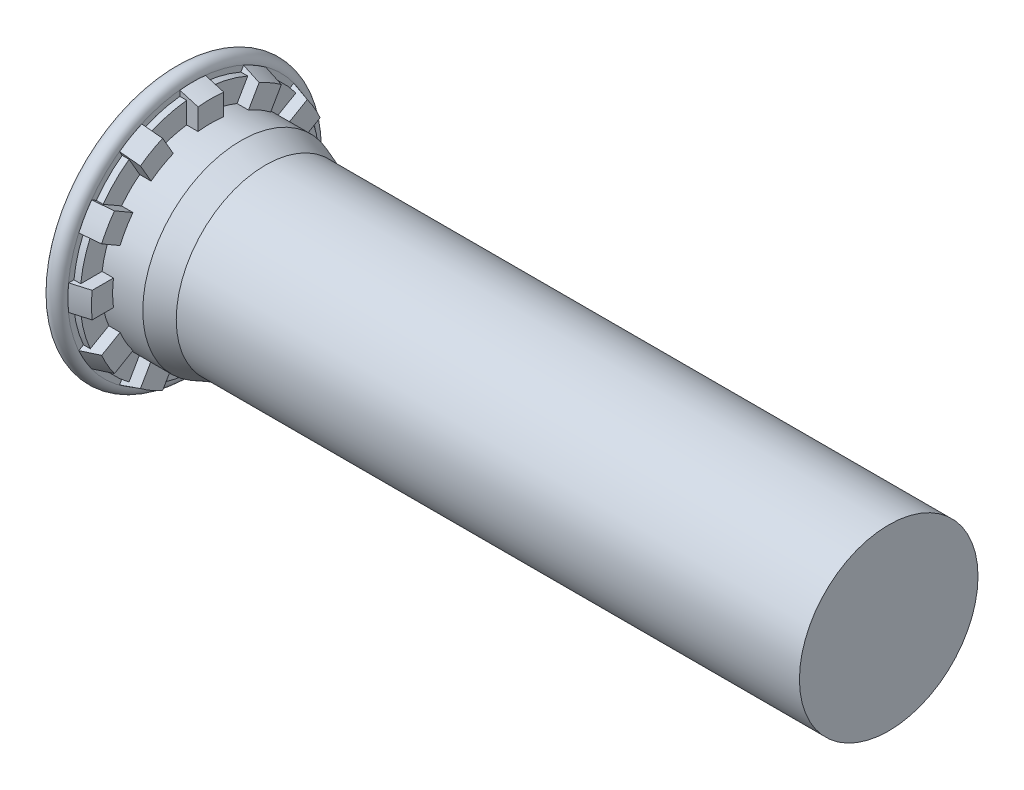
SolidWorks part; units mm, degrees
ref_plane "Plane1" through (0, 0, 0) normal (0, 0, 1) x (1, 0, 0)
ref_plane "Plane2" through (0, 0, 0) normal (0, 1, 0) x (1, 0, 0)
ref_plane "Plane3" through (0, 0, 0) normal (1, 0, 0) x (0, 0, -1)
sketch "BodySke" plane through (0, 0, 0) normal (0, 0, 1) x (1, 0, 0)
  line L0 (0, 0) -> (0, 3.4925)
  line L1 (0.51, 3.4975) -> (0.51, 3.4925)
  line L2 (0.51, 3.4925) -> (1.02, 3.3436)
  line L3 (2.55, 2.5) -> (20, 2.5)
  line L4 (20, 2.5) -> (20, 0)
  line L5 (20, 0) -> (0, 0)
  line L6 (0, 0) -> (50.554, 0) construction
  line L7 (1.02, 3.3436) -> (1.02, 2.75)
  line L8 (1.8631, 2.75) -> (1.02, 2.75)
  line L9 (-9.525, 3.75) -> (9.525, 3.75) construction
  line L11 (2.55, 2.5) -> (1.8631, 2.75)
  line L13 (9.525, -3.75) -> (-9.525, -3.75) construction
  line L14 (0.0051, 3.4975) -> (0.0051, 3.4925)
  line L15 (0, 3.4925) -> (0.0051, 3.4925)
  arc A0 (0.0051, 3.4975) -> (0.51, 3.4975) centre (0.2575, 3.4975) cw
  dimension "D2" = 0.0051
  dimension "D1" = 0.0051
  dimension "Diameter" = 5
  dimension "D3" = 20
  dimension "Length" = 20
  dimension "H_dia" = 7.5
  dimension "Shoulder_lower_dia" = 6.985
  dimension "Shoulder_upper_dia" = 6.6873
  dimension "Shoulder_ht" = 1.02
  dimension "T_dim" = 0.51
  dimension "Neck_len" = 2.55
  dimension "Neck_dia" = 5.5
revolve "BaseBody" add sketch "BodySke" angle 360 about L6
sketch "RibCut1Ske" plane through (1.02, 0, 0) normal (1, 0, 0) x (0, 0, -1)
  line L0 (0.3589, 2.7265) -> (0.3589, 3.7328)
  line L1 (1.0524, 2.5407) -> (1.5555, 3.4122)
  line L2 (0, 0) -> (0, 4.9784) construction
  line L3 (0, 0) -> (0.3589, 2.7265) construction
  line L4 (0, 0) -> (1.0524, 2.5407) construction
  arc A1 (1.0524, 2.5407) -> (0.3589, 2.7265) centre (0, 0) ccw
  arc A2 (1.5555, 3.4122) -> (0.3589, 3.7328) centre (0, 0) ccw
  dimension "Inner_dia" = 5.5
  dimension "Outer_dia" = 7.5
  dimension "Rib_root_half_angle" = 7.5
  dimension "Rib_root_gap_angle" = 15
  dimension "Angle" = 30
extrude "RibCut1" cut sketch "RibCut1Ske" against normal blind 0.3187
sketch "RibCut2Ske" plane through (1.02, 0, 0) normal (1, 0, 0) x (0, 0, -1)
  line L0 (0.3589, 3.3243) -> (0.3589, 3.7328)
  line L1 (1.3513, 3.0584) -> (1.5555, 3.4122)
  line L2 (0.3589, 2.7265) -> (0.3589, 4.5382) construction
  line L3 (0, 0) -> (0, 5.0239) construction
  line L4 (0, 0) -> (0.3589, 2.7265) construction
  line L5 (0, 0) -> (1.0524, 2.5407) construction
  line L6 (1.0524, 2.5407) -> (1.9618, 4.1158) construction
  arc A1 (1.3513, 3.0584) -> (0.3589, 3.3243) centre (0, 0) ccw
  arc A2 (1.5555, 3.4122) -> (0.3589, 3.7328) centre (0, 0) ccw
  circle A4 centre (0, 0) radius 2.75 construction
  dimension "Inner_dia" = 6.6873
  dimension "Outer_dia" = 7.5
  dimension "Rib_root_dia" = 5.5
  dimension "Rib_root_half_angle" = 7.5
  dimension "Rib_root_gap_angle" = 15
  dimension "Angle" = 30
extrude "RibCut2" cut sketch "RibCut2Ske" against normal blind 0.51
pattern_circular "RibCutsPat" count 12 every 30 about axis through (0, 0, 0) along (1, 0, 0) of "RibCut2", "RibCut1"
equation "' \"Diameter@BodySke\" = 5"
equation "' \"Length@BodySke\" = 20"
equation "' \"Neck_dia@BodySke\" = 5.5"
equation "' \"H_dia@BodySke\" = 7.5"
equation "' \"Neck_len@BodySke\" = 2.55"
equation "\"T_dim@BodySke\" = \"Neck_len@BodySke\" * 0.2"
equation "\"Shoulder_ht@BodySke\" = \"Neck_len@BodySke\" * 0.4"
equation "\"Shoulder_lower_dia@BodySke\" = \"H_dia@BodySke\" - \"Neck_len@BodySke\" * 0.2 - .005"
equation "\"Shoulder_upper_dia@BodySke\" = ( \"Shoulder_lower_dia@BodySke\" + \"Diameter@BodySke\" ) /2"
equation "\"Shoulder_upper_dia@BodySke\" = \"Diameter@BodySke\" +  ( \"Shoulder_lower_dia@BodySke\" - \"Diameter@BodySke\" ) * 0.85"
equation "\"Num_ribs@RibCutsPat\" = 12"
equation "\"Angle@RibCutsPat\" = 360 / \"Num_ribs@RibCutsPat\""
equation "\"Angle@RibCut1Ske\" =\"Angle@RibCutsPat\""
equation "\"Rib_root_half_angle@RibCut1Ske\" = \"Angle@RibCut1Ske\" / 4"
equation "\"Rib_root_gap_angle@RibCut1Ske\" = \"Angle@RibCut1Ske\" - (2 * \"Rib_root_half_angle@RibCut1Ske\" )"
equation "\"Inner_dia@RibCut1Ske\" = \"Neck_dia@BodySke\""
equation "\"Outer_dia@RibCut1Ske\" = \"H_dia@BodySke\""
equation "\"Depth@RibCut1\" =  \"Neck_len@BodySke\" * 0.125"
equation "\"Angle@RibCut2Ske\" =\"Angle@RibCutsPat\""
equation "\"Rib_root_half_angle@RibCut2Ske\" = \"Angle@RibCut1Ske\" / 4"
equation "\"Rib_root_gap_angle@RibCut2Ske\" = \"Angle@RibCut1Ske\" - (2 * \"Rib_root_half_angle@RibCut1Ske\" )"
equation "\"Rib_root_dia@RibCut2Ske\" = \"Neck_dia@BodySke\""
equation "\"Inner_dia@RibCut2Ske\" = \"Shoulder_upper_dia@BodySke\""
equation "\"Outer_dia@RibCut2Ske\" = \"H_dia@BodySke\""
equation "\"Depth@RibCut2\" =  \"Neck_len@BodySke\" * 0.2"
